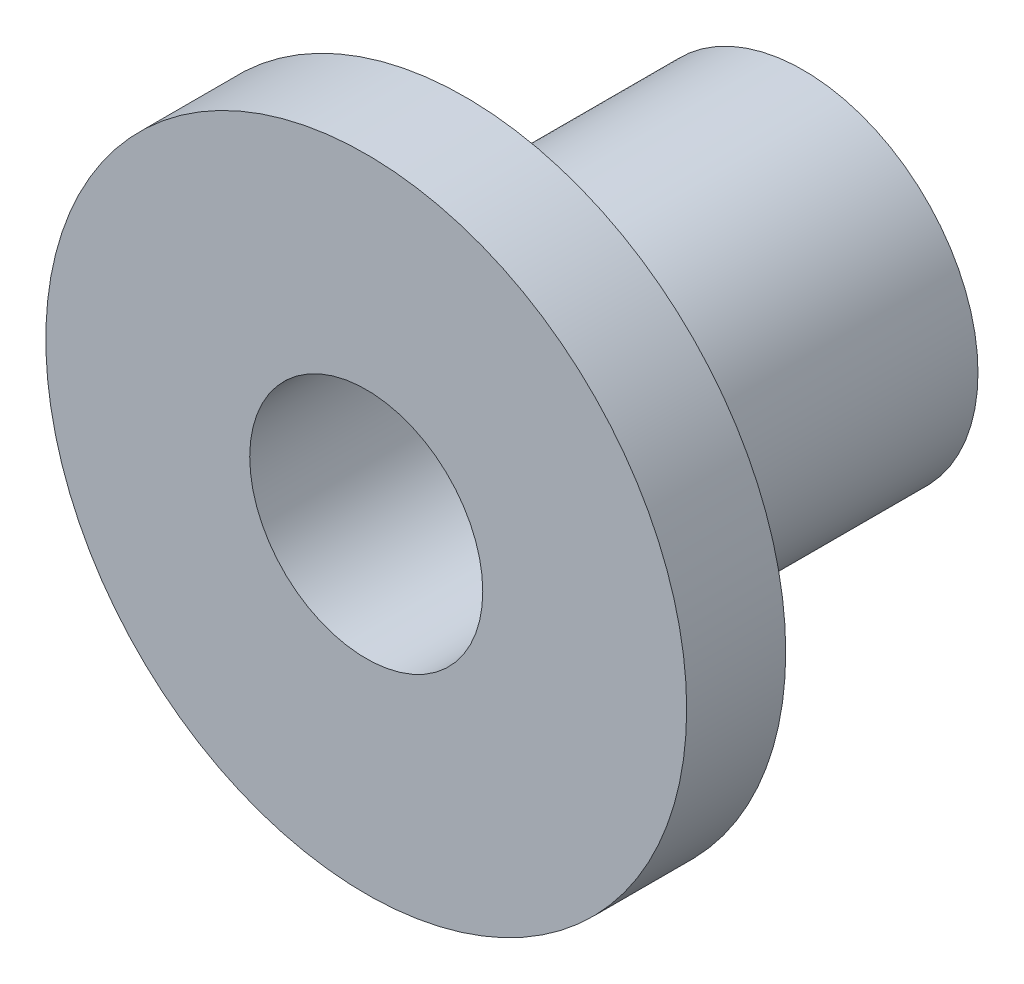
SolidWorks part; units mm, degrees
ref_plane "Alzado" through (0, 0, 0) normal (0, 0, 1) x (1, 0, 0)
ref_plane "Planta" through (0, 0, 0) normal (0, 1, 0) x (1, 0, 0)
ref_plane "Vista lateral" through (0, 0, 0) normal (1, 0, 0) x (0, 0, -1)
sketch "Sketch1" plane through (0, 0, 0) normal (0, 0, 1) x (1, 0, 0)
  circle A0 centre (0, 0) radius 6
  circle A1 centre (0, 0) radius 4
  dimension "D1" = 8
  dimension "D2" = 12
extrude "Boss-Extrude1" add sketch "Sketch1" along normal blind 15
sketch "Sketch2" plane through (0, 0, 15) normal (0, 0, 1) x (1, 0, 0)
  circle A0 centre (0, 0) radius 4
  circle A1 centre (0, 0) radius 11
  circle A2 centre (0, 0) radius 4 construction
  dimension "D1" = 22
extrude "Boss-Extrude2" add sketch "Sketch2" against normal blind 3.4
